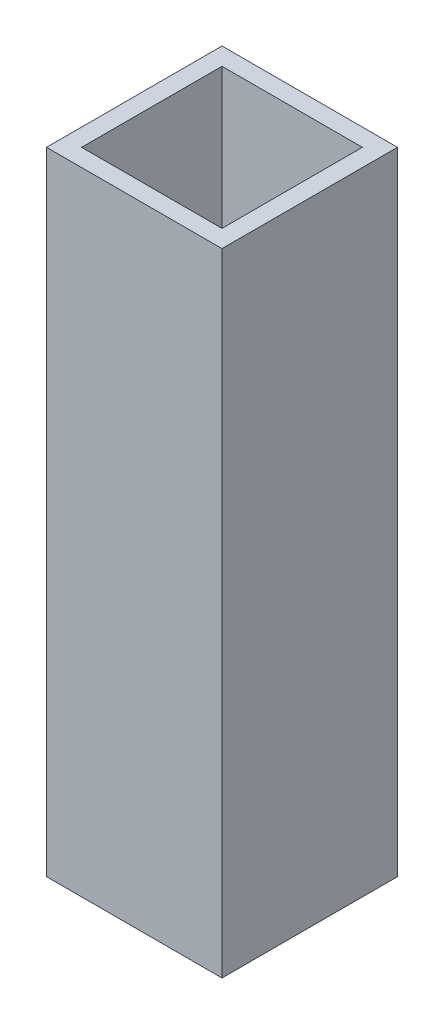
SolidWorks part; units mm, degrees
ref_plane "前视基准面" through (0, 0, 0) normal (0, 0, 1) x (1, 0, 0)
ref_plane "上视基准面" through (0, 0, 0) normal (0, 1, 0) x (1, 0, 0)
ref_plane "右视基准面" through (0, 0, 0) normal (1, 0, 0) x (0, 0, -1)
other "Configuration Table"
sketch "草图1" plane through (0, 0, 0) normal (0, 1, 0) x (1, 0, 0)
  line L1 (-6.25, 6.25) -> (6.25, 6.25)
  line L2 (-6.25, 6.25) -> (-6.25, -6.25)
  line L3 (-6.25, -6.25) -> (6.25, -6.25)
  line L4 (6.25, 6.25) -> (6.25, -6.25)
  line L5 (-6.25, 6.25) -> (6.25, -6.25) construction
  line L6 (-6.25, -6.25) -> (6.25, 6.25) construction
  point P0 (0, 0)
  dimension "D1" = 12.5
extrude "凸台-拉伸1" add sketch "草图1" along normal blind 45
sketch "草图2" plane through (0, 45, 0) normal (0, 1, 0) x (1, 0, 0)
  line L1 (-5, 5) -> (5, 5)
  line L2 (-5, 5) -> (-5, -5)
  line L3 (-5, -5) -> (5, -5)
  line L4 (5, 5) -> (5, -5)
  line L5 (-5, 5) -> (5, -5) construction
  line L6 (-5, -5) -> (5, 5) construction
  point P0 (0, 0)
  dimension "D1" = 10
extrude "切除-拉伸1" cut sketch "草图2" against normal blind 42.5
